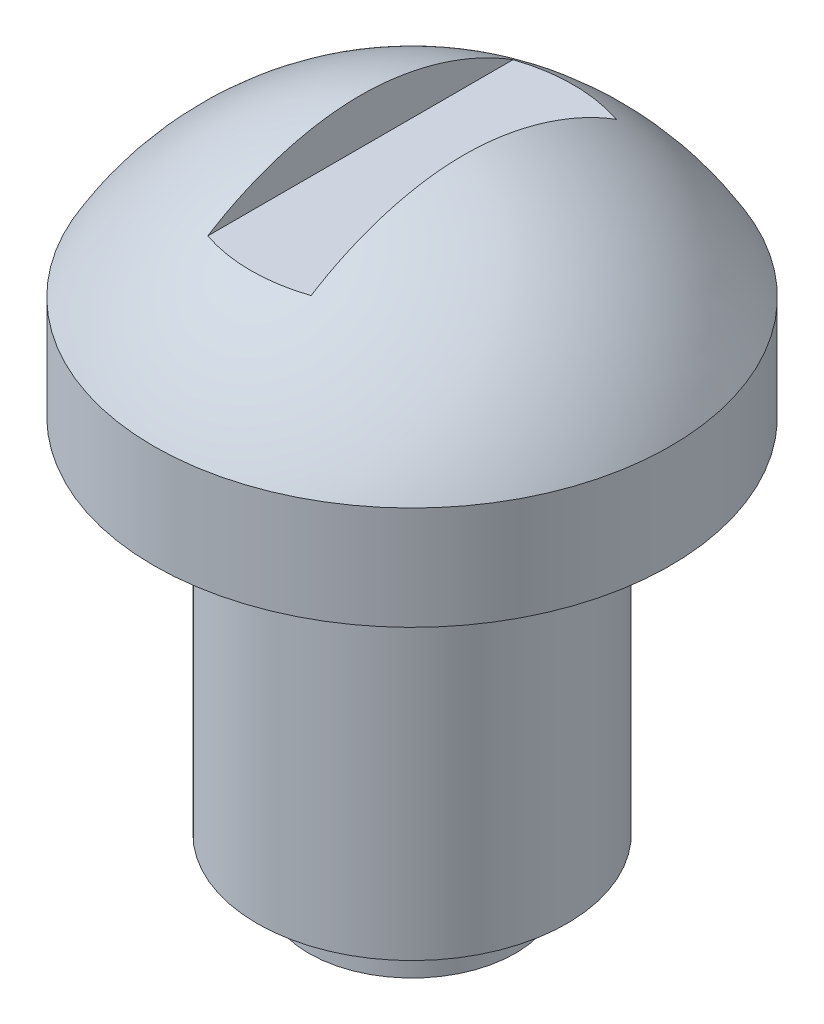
SolidWorks part; units mm, degrees
ref_plane "Front Plane" through (0, 0, 0) normal (0, 0, 1) x (1, 0, 0)
ref_plane "Top Plane" through (0, 0, 0) normal (0, 1, 0) x (1, 0, 0)
ref_plane "Right Plane" through (0, 0, 0) normal (1, 0, 0) x (0, 0, -1)
sketch "Sketch1" plane through (0, 0, 0) normal (0, 0, 1) x (1, 0, 0)
  line L0 (0, 0) -> (2, 0)
  line L1 (2, 0) -> (2, 1)
  line L2 (2, 1) -> (3, 1)
  line L3 (3, 1) -> (3, 8)
  line L4 (3, 8) -> (5, 8)
  line L5 (5, 8) -> (5, 10)
  line L6 (0, 10) -> (0, 0)
  line L7 (0, 0) -> (0, -6.4866) construction
  line L8 (0, 10) -> (5, 10)
  dimension "D1" = 4
  dimension "D2" = 6
  dimension "D3" = 10
  dimension "D4" = 1
  dimension "D5" = 7
  dimension "D6" = 2
revolve "Revolve1" add sketch "Sketch1" angle 360 about L7
sketch "Sketch6" plane through (0, 0, 0) normal (0, 0, 1) x (1, 0, 0)
  line L0 (0, 0) -> (0, 16.3719) construction
  line L1 (-5, 8) -> (5, 8) construction
  line L2 (0, 13) -> (0, 10)
  line L3 (5, 10) -> (-5, 10) construction
  line L4 (0, 10) -> (5, 10)
  arc A0 (5, 10) -> (0, 13) centre (-0.198, 7.0033) ccw
  dimension "D1" = 6
  dimension "D2" = 5
revolve "Revolve3" add sketch "Sketch6" angle 360 about L0
sketch "Sketch7" plane through (0, 0, 0) normal (0, 0, 1) x (1, 0, 0)
  line L1 (1, 12.0033) -> (-1, 12.0033)
  line L2 (1, 12.0033) -> (1, 13.0033)
  line L3 (1, 13.0033) -> (-1, 13.0033)
  line L4 (-1, 12.0033) -> (-1, 13.0033)
  line L5 (1, 12.0033) -> (-1, 13.0033) construction
  line L6 (1, 13.0033) -> (-1, 12.0033) construction
  arc A0 (0, 13) -> (-5, 10) centre (0.198, 7.0033) ccw construction
  point P0 (0, 12.5033)
  dimension "D1" = 2
  dimension "D2" = 1
extrude "Cut-Extrude1" cut sketch "Sketch7" against normal through all and the other way through all
